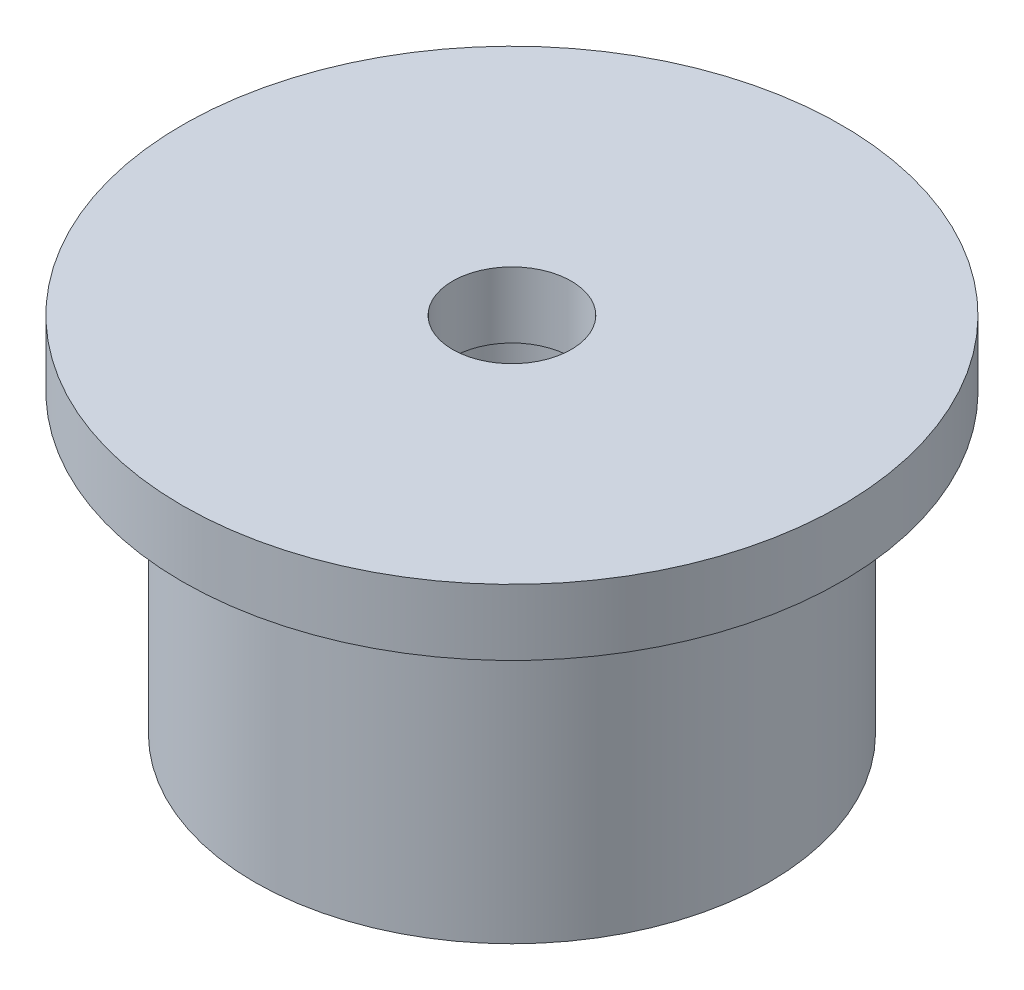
SolidWorks part; units mm, degrees
ref_plane "Front Plane" through (0, 0, 0) normal (0, 0, 1) x (1, 0, 0)
ref_plane "Top Plane" through (0, 0, 0) normal (0, 1, 0) x (1, 0, 0)
ref_plane "Right Plane" through (0, 0, 0) normal (1, 0, 0) x (0, 0, -1)
sketch "Sketch1" plane through (0, 0, 0) normal (0, 1, 0) x (1, 0, 0)
  circle A0 centre (0, 0) radius 5
  dimension "D1" = 10
extrude "Boss-Extrude1" add sketch "Sketch1" along normal mid plane 1
sketch "Sketch2" plane through (0, -0.5, 0) normal (0, -1, 0) x (-1, 0, 0)
  circle A0 centre (0, 0) radius 3.9
  dimension "D1" = 7.8
extrude "Boss-Extrude2" add sketch "Sketch2" along normal blind 4.5
sketch "Sketch4" plane through (0, -5, 0) normal (0, -1, 0) x (-1, 0, 0)
  circle A0 centre (0, 0) radius 1
  dimension "D1" = 2
extrude "Cut-Extrude1" cut sketch "Sketch4" against normal blind 4.5
sketch "Sketch5" plane through (0, 0.5, 0) normal (0, 1, 0) x (1, 0, 0)
  circle A0 centre (0, 0) radius 0.9
  dimension "D1" = 1.8
extrude "Cut-Extrude2" cut sketch "Sketch5" against normal up to next
chamfer "Chamfer1" distance 0.2 angle 45 1 edges at (0, -5, -1)
